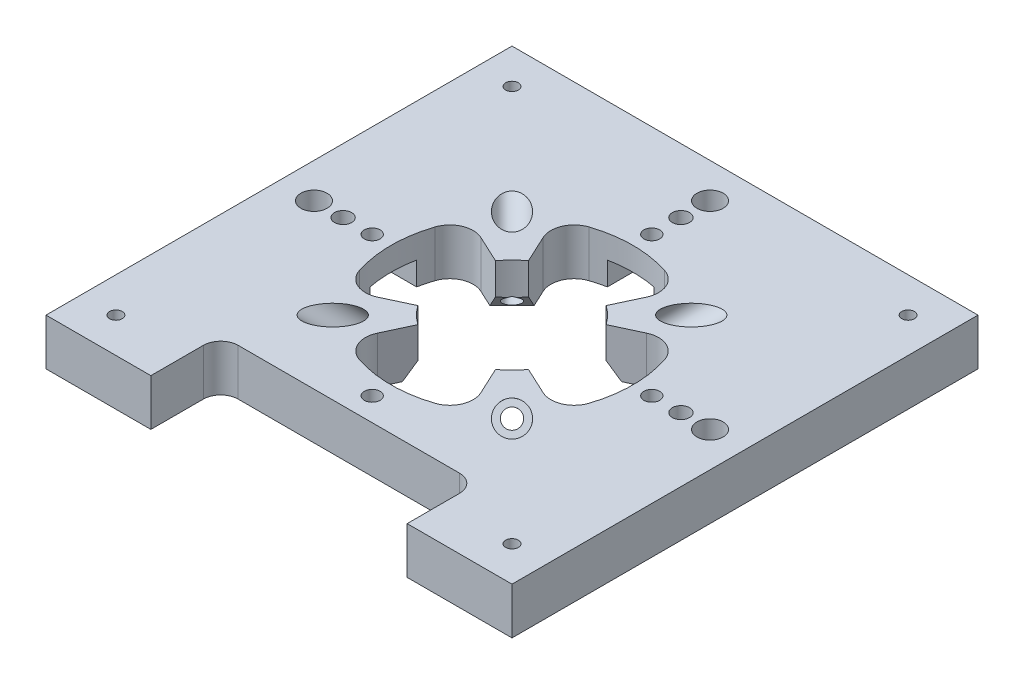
SolidWorks part; units mm, degrees
ref_plane "Front" through (0, 0, 0) normal (0, 0, 1) x (1, 0, 0)
ref_plane "Top" through (0, 0, 0) normal (0, 1, 0) x (1, 0, 0)
ref_plane "Right" through (0, 0, 0) normal (1, 0, 0) x (0, 0, -1)
sketch "Sketch1" plane through (0, 0, 0) normal (0, 1, 0) x (1, 0, 0)
  line L1 (-63.5, -63.5) -> (63.5, -63.5)
  line L2 (-63.5, -63.5) -> (-63.5, 63.5)
  line L3 (-63.5, 63.5) -> (63.5, 63.5)
  line L4 (63.5, -63.5) -> (63.5, 63.5)
  line L5 (-63.5, -63.5) -> (63.5, 63.5) construction
  line L6 (-63.5, 63.5) -> (63.5, -63.5) construction
  point P0 (0, 0)
  dimension "D1" = 127
  dimension "D2" = 127
extrude "Boss-Extrude1" add sketch "Sketch1" along normal blind 12.7
hole_wizard "#8-32 Tapped Hole1" positions "Sketch2" profile "Sketch3" tap size "#8-32" standard "ANSI Inch"
sketch "Sketch2" plane through (0, 12.7, 0) normal (0, 1, 0) x (1, 0, 0)
  line L0 (-63.5, -63.5) -> (63.5, -63.5) construction
  line L1 (-63.5, 63.5) -> (-63.5, -63.5) construction
  line L2 (63.5, 63.5) -> (-63.5, 63.5) construction
  line L3 (63.5, -63.5) -> (63.5, 63.5) construction
  point P0 (-53.975, 53.975)
  point P2 (53.975, 53.975)
  point P4 (53.975, -53.975)
  point P6 (-53.975, -53.975)
  point P9 (0, 0)
  point P10 (0, 0)
  point P11 (0, 0)
  point P12 (0, 0)
  dimension "D1" = 9.525
  dimension "D2" = 9.525
  dimension "D3" = 9.525
  dimension "D4" = 9.525
sketch "Sketch3" plane through (-53.975, 12.7, -53.975) normal (1, 0, 0) x (0, 0, 1)
  line L0 (0, 0) -> (0, 12.7)
  line L1 (0, 12.7) -> (1.7272, 12.7)
  line L2 (1.7272, 12.7) -> (1.7272, 0)
  line L5 (1.7272, 0) -> (0, 0)
  line L11 (0, -6.35) -> (0, 107.95) construction
  dimension "Thru Tap Drill Dia." = 3.4544
  dimension "Thru Tap Drill Depth" = 12.7
sketch "Sketch4" plane through (0, 12.7, 0) normal (0, 1, 0) x (1, 0, 0)
  circle A0 centre (0, 0) radius 18.415
  dimension "D1" = 36.83
extrude "Cut-Extrude1" cut sketch "Sketch4" against normal blind 12.7
sketch "Sketch5" plane through (0, 12.7, 0) normal (0, 1, 0) x (1, 0, 0)
  line L0 (34.925, -63.5) -> (34.925, -49.2125)
  line L1 (-63.5, -63.5) -> (63.5, -63.5) construction
  line L2 (30.1625, -44.45) -> (-30.1625, -44.45)
  line L3 (-34.925, -49.2125) -> (-34.925, -63.5)
  line L4 (-34.925, -63.5) -> (34.925, -63.5)
  line L5 (63.5, -63.5) -> (63.5, 63.5) construction
  line L6 (-63.5, 63.5) -> (-63.5, -63.5) construction
  arc A0 (34.925, -49.2125) -> (30.1625, -44.45) centre (30.1625, -49.2125) ccw
  arc A1 (-30.1625, -44.45) -> (-34.925, -49.2125) centre (-30.1625, -49.2125) ccw
extrude "Cut-Extrude2" cut sketch "Sketch5" against normal blind 12.7
sketch "Sketch6" plane through (0, 12.7, 0) normal (0, 1, 0) x (1, 0, 0)
  line L0 (0, 0) -> (76.0856, 0) construction
  line L1 (7.62, -10.5248) -> (7.62, 41.6607) construction
  line L2 (7.62, 0) -> (-22.5853, -14.085)
  line L3 (7.62, 0) -> (-22.5853, 14.085)
  arc A1 (-31.2997, 10.318) -> (-31.2997, -10.318) centre (0, 0) ccw
  arc A2 (-22.5853, -14.085) -> (-31.2997, -10.318) centre (-25.2689, -8.3299) cw
  arc A3 (-22.5853, 14.085) -> (-31.2997, 10.318) centre (-25.2689, 8.3299) ccw
  dimension "D1" = 32.9565
  dimension "D4" = 6.35
  dimension "D2" = 7.62
  dimension "D3" = 25
  dimension "D5" = 25
extrude "Cut-Extrude3" cut sketch "Sketch6" against normal blind 12.7
pattern_circular "CirPattern1" count 4 every 90 about axis through (0, 0, 0) along (0, 1, 0) of "Cut-Extrude3"
sketch "Sketch8" plane through (0, 0, 0) normal (0, 1, 0) x (1, 0, 0)
  line L0 (63.5, 63.5) -> (-63.5, -63.5)
  line L1 (-63.5, -63.5) -> (-34.925, -63.5) construction
  line L2 (-63.5, 63.5) -> (-63.5, -63.5) construction
  point P5 (-63.5, -63.5)
  point P8 (63.5, 63.5)
sketch "Sketch9" plane through (0, 12.7, 0) normal (0, 1, 0) x (1, 0, 0)
  line L0 (63.5, 63.5) -> (-63.5, -63.5)
ref_plane "Plane1" through (0, 0, 0) normal (0.7071, 0, 0.7071) x (0.7071, 0, -0.7071)
sketch "Sketch10" plane through (0, 0, 0) normal (0.7071, 0, 0.7071) x (0.7071, 0, -0.7071)
  line L0 (0, 0) -> (0, -11.7602)
  line L1 (0, -11.7602) -> (71.8725, 39.1283)
  line L2 (0, -11.7602) -> (15.7722, -34.036)
  line L3 (19.6105, 2.1248) -> (33.2537, -17.1442)
  line L4 (25.9124, 6.5868) -> (40.766, -14.3917)
  line L5 (89.8026, 12.7) -> (-89.8026, 12.7) construction
  line L6 (89.8026, 12.7) -> (-89.8026, 12.7)
  line L7 (46.6423, 21.2644) -> (35.0061, 37.6987)
  dimension "D1" = 11.7602
  dimension "D2" = 54.7
  dimension "D3" = 90
  dimension "D4" = 24.0284
  dimension "D5" = 7.7216
  dimension "D6" = 25.4
ref_plane "Plane2" through (17.9605, 0, 17.9605) normal (0.7071, 0, 0.7071) x (0.7071, 0, -0.7071)
sketch "Sketch11" plane through (17.9605, 0, 17.9605) normal (0.7071, 0, 0.7071) x (0.7071, 0, -0.7071)
  line L0 (46.6423, 21.2644) -> (35.0061, 37.6987)
ref_plane "Plane3" through (29.0593, 29.0976, -29.0593) normal (-0.5771, -0.5779, 0.5771) x (-0.8167, 0.4083, -0.4078)
hole_wizard "CBORE for #8 Socket Head Cap Screw1" positions "Sketch12" profile "Sketch13" counterbore size "#8" standard "ANSI Inch"
sketch "Sketch12" plane through (29.0593, 29.0976, -29.0593) normal (-0.5771, -0.5779, 0.5771) x (-0.8167, 0.4083, -0.4078)
  point P0 (-4.8021, 8.3102)
sketch "Sketch13" plane through (32.9811, 21.2644, -32.9811) normal (0.7071, 0, 0.7071) x (-0.4086, 0.8161, 0.4086)
  line L0 (0, 0) -> (0, 123.6455)
  line L1 (0, 123.6455) -> (2.2479, 123.6455)
  line L3 (2.2479, 123.6455) -> (2.2479, 25.3746)
  line L4 (2.2479, 25.3746) -> (3.9687, 25.3746)
  line L5 (3.9687, 25.3746) -> (3.9688, 0)
  line L7 (3.9688, 0) -> (0, 0)
  line L11 (0, -6.35) -> (0, 107.95) construction
  dimension "Thru Hole Dia." = 4.4958
  dimension "Thru Hole Depth" = 123.6455
  dimension "C'Bore Dia." = 7.9375
  dimension "C'Bore Depth" = 25.3746
pattern_circular "CirPattern2" count 4 every 90 about axis through (0, 0, 0) along (0, 1, 0) of "CBORE for #8 Socket Head Cap Screw1"
sketch "Sketch14" plane through (0, 0, 0) normal (0.7071, 0, 0.7071) x (0.7071, 0, -0.7071)
  line L0 (21.1149, 0) -> (16.5711, 6.4175)
  line L1 (89.8026, 0) -> (-89.8026, 0) construction
  line L2 (19.6105, 2.1248) -> (33.2537, -17.1442) construction
  line L3 (16.5711, 6.4175) -> (12.0272, 0)
  line L4 (12.0272, 0) -> (21.1149, 0)
  point P6 (14.59, 0)
  point P8 (16.5711, 6.4175)
extrude "Cut-Extrude4" cut sketch "Sketch14" against normal mid plane 10.16
pattern_circular "CirPattern3" count 4 every 90 about axis through (0, 0, 0) along (0, 1, 0) of "Cut-Extrude4"
hole_wizard "#18 (0.1695) Diameter Hole1" positions "Sketch15" profile "Sketch16" hole size "#18" standard "ANSI Inch"
sketch "Sketch15" plane through (0, 12.7, 0) normal (0, 1, 0) x (1, 0, 0)
  line L0 (-63.5, 63.5) -> (-63.5, -63.5) construction
  line L1 (63.5, -63.5) -> (63.5, 63.5) construction
  line L2 (63.5, 63.5) -> (-63.5, 63.5) construction
  line L3 (34.925, -63.5) -> (63.5, -63.5) construction
  point P0 (-38.1, 0)
  point P2 (38.1, 0)
  point P4 (0, 38.1)
  point P16 (0, -38.1)
  dimension "D1" = 25.4
  dimension "D2" = 25.4
  dimension "D3" = 25.4
  dimension "D4" = 25.4
sketch "Sketch16" plane through (-38.1, 12.7, 0) normal (1, 0, 0) x (0, 0, 1)
  line L0 (0, 0) -> (0, 12.7)
  line L1 (0, 12.7) -> (2.1526, 12.7)
  line L2 (2.1526, 12.7) -> (2.1526, 0)
  line L5 (2.1526, 0) -> (0, 0)
  line L11 (0, -6.35) -> (0, 107.95) construction
  dimension "Thru Hole Dia." = 4.3053
  dimension "Thru Hole Depth" = 12.7
hole_wizard "#13 (0.185) Diameter Hole1" positions "Sketch17" profile "Sketch18" hole size "#13" standard "ANSI Inch"
sketch "Sketch17" plane through (0, 12.7, 0) normal (0, 1, 0) x (1, 0, 0)
  line L0 (-63.5, 63.5) -> (-63.5, -63.5) construction
  line L1 (63.5, 63.5) -> (-63.5, 63.5) construction
  line L2 (63.5, -63.5) -> (63.5, 63.5) construction
  point P0 (-46.0375, 0)
  point P2 (46.0375, 0)
  point P4 (0, 46.0375)
  point P7 (0, 0)
  point P9 (0, 0)
  point P13 (0, 0)
  point P20 (-46.0375, 11.933)
sketch "Sketch18" plane through (-46.0375, 12.7, 0) normal (1, 0, 0) x (0, 0, 1)
  line L0 (0, 0) -> (0, 12.7)
  line L1 (0, 12.7) -> (2.3495, 12.7)
  line L2 (2.3495, 12.7) -> (2.3495, 0)
  line L5 (2.3495, 0) -> (0, 0)
  line L11 (0, -6.35) -> (0, 107.95) construction
  dimension "Thru Hole Dia." = 4.699
  dimension "Thru Hole Depth" = 12.7
hole_wizard "9/32 (0.28125) Diameter Hole1" positions "Sketch19" profile "Sketch20" hole size "9/32" standard "ANSI Inch"
sketch "Sketch19" plane through (0, 0, 0) normal (0, -1, 0) x (-1, 0, 0)
  line L0 (-63.5, -63.5) -> (-63.5, 63.5) construction
  line L1 (-63.5, 63.5) -> (63.5, 63.5) construction
  line L2 (63.5, 63.5) -> (63.5, -63.5) construction
  point P0 (-53.975, 0)
  point P2 (53.975, 0)
  point P4 (0, 53.975)
  dimension "D1" = 9.525
  dimension "D2" = 9.525
  dimension "D3" = 9.525
sketch "Sketch20" plane through (53.975, 0, 0) normal (1, 0, 0) x (0, 0, -1)
  line L0 (0, 0) -> (0, 12.7)
  line L1 (0, 12.7) -> (3.5719, 12.7)
  line L2 (3.5719, 12.7) -> (3.5719, 0)
  line L5 (3.5719, 0) -> (0, 0)
  line L11 (0, -6.35) -> (0, 107.95) construction
  dimension "Thru Hole Dia." = 7.1437
  dimension "Thru Hole Depth" = 12.7
sketch "Sketch21" plane through (0, 0, 0) normal (0, -1, 0) x (1, 0, 0)
  line L0 (-63.5, 6.35) -> (-29.21, 6.35)
  line L1 (-63.5, -63.5) -> (-63.5, 63.5) construction
  line L2 (-29.21, 6.35) -> (-29.21, -6.35)
  line L3 (-29.21, -6.35) -> (-63.5, -6.35)
  line L4 (-63.5, -6.35) -> (-63.5, 6.35)
  point P4 (-63.5, 0)
  point P10 (0, 0)
  point P12 (26.4695, -8.0276)
  dimension "D1" = 12.7
  dimension "D2" = 34.29
extrude "Cut-Extrude5" cut sketch "Sketch21" against normal blind 6.35
sketch "Sketch22" plane through (0, 0, 0) normal (0, -1, 0) x (1, 0, 0)
  line L0 (-6.35, -29.083) -> (-6.35, -63.5)
  line L1 (63.5, -63.5) -> (-63.5, -63.5) construction
  line L2 (-6.35, -63.5) -> (6.35, -63.5)
  line L3 (6.35, -63.5) -> (6.35, -29.083)
  line L4 (6.35, -29.083) -> (-6.35, -29.083)
  point P4 (0, -63.5)
  dimension "D1" = 12.7
  dimension "D2" = 34.417
extrude "Cut-Extrude6" cut sketch "Sketch22" against normal blind 6.35
sketch "Sketch23" plane through (0, 0, 0) normal (0, -1, 0) x (1, 0, 0)
  circle A0 centre (53.975, 0) radius 5.4864
  dimension "D1" = 10.9728
extrude "Cut-Extrude7" cut sketch "Sketch23" against normal blind 6.35
equation "\"D2@Sketch5\"=\"D1@Sketch5\""
equation "\"D3@Sketch17\"=\"D1@Sketch17\""
